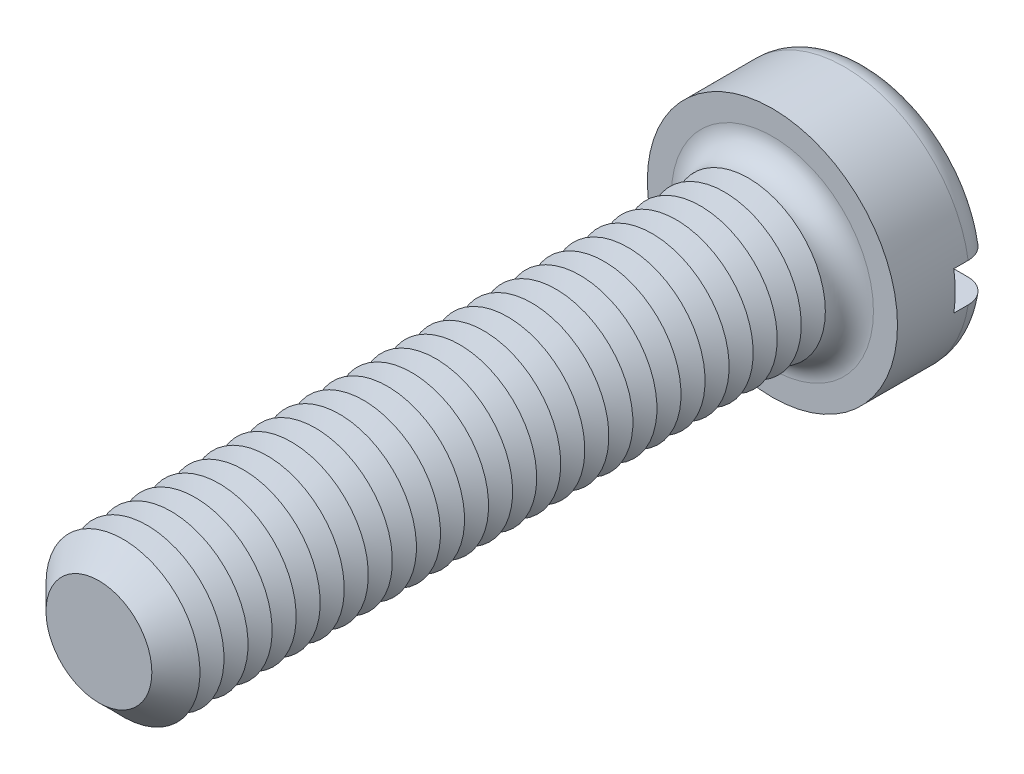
SolidWorks part; units mm, degrees
ref_plane "Front Plane" through (0, 0, 0) normal (0, 0, 1) x (1, 0, 0)
ref_plane "Top Plane" through (0, 0, 0) normal (0, 1, 0) x (1, 0, 0)
ref_plane "Right Plane" through (0, 0, 0) normal (1, 0, 0) x (0, 0, -1)
sketch "Sketch3" plane through (0, 0, 0) normal (0, 0, 1) x (1, 0, 0)
  circle A0 centre (0, 0) radius 6.5
  dimension "D1" = 13
extrude "Boss-Extrude2" add sketch "Sketch3" against normal blind 5
sketch "Sketch4" plane through (0, 0, 0) normal (0, 0, 1) x (1, 0, 0)
  circle A0 centre (0, 0) radius 4
  dimension "D1" = 8
extrude "Boss-Extrude3" add sketch "Sketch4" along normal blind 35
fillet "Fillet1" radius 1.25 2 edges at (6.5, 0, -5) (4, 0, 0)
chamfer "Chamfer1" distance 1.25 angle 45 1 edges at (4, 0, 35)
sketch "Sketch5" plane through (0, 0, 0) normal (1, 0, 0) x (0, 0, -1)
  line L0 (1.6944, 0) -> (-7.6738, 0) construction
sketch "Sketch6" plane through (0, 0, 0) normal (1, 0, 0) x (0, 0, -1)
  line L0 (-1.25, 4) -> (-1.875, 2.9175)
  line L1 (-1.875, 2.9175) -> (-2.5, 4)
  line L2 (-1.25, 4) -> (-33.75, 4) construction
  line L3 (-2.5, 4) -> (-1.25, 4)
  dimension "D1" = 1.25
revolve "Cut-Revolve1" cut sketch "Sketch6" angle 360 about L0
pattern_linear "LPattern1" count 26 spacing 1.25 along (0, 0, 1) of "Cut-Revolve1"
sketch "Sketch8" plane through (0, 0, -5) normal (0, 0, -1) x (-1, 0, 0)
  line L1 (6.5, -1) -> (-6.5, -1)
  line L2 (6.5, -1) -> (6.5, 1)
  line L3 (6.5, 1) -> (-6.5, 1)
  line L4 (-6.5, -1) -> (-6.5, 1)
  line L5 (6.5, -1) -> (-6.5, 1) construction
  line L6 (6.5, 1) -> (-6.5, -1) construction
  point P0 (0, 0)
  dimension "D1" = 13
  dimension "D2" = 2
extrude "Cut-Extrude1" cut sketch "Sketch8" against normal blind 2
